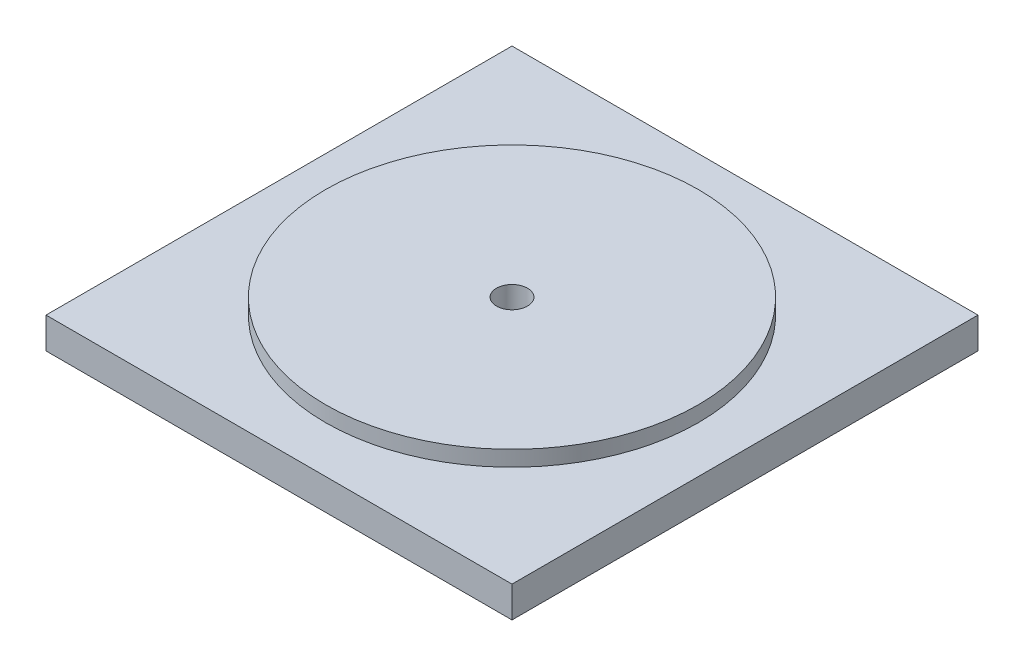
SolidWorks part; units mm, degrees
ref_plane "Front Plane" through (0, 0, 0) normal (0, 0, 1) x (1, 0, 0)
ref_plane "Top Plane" through (0, 0, 0) normal (0, 1, 0) x (1, 0, 0)
ref_plane "Right Plane" through (0, 0, 0) normal (1, 0, 0) x (0, 0, -1)
sketch "Sketch1" plane through (0, 0, 0) normal (0, 1, 0) x (1, 0, 0)
  line L1 (-75, 75) -> (75, 75)
  line L2 (-75, 75) -> (-75, -75)
  line L3 (-75, -75) -> (75, -75)
  line L4 (75, 75) -> (75, -75)
  line L5 (-75, 75) -> (75, -75) construction
  line L6 (-75, -75) -> (75, 75) construction
  point P0 (0, 0)
  dimension "D1" = 150
  dimension "D2" = 150
extrude "Boss-Extrude1" add sketch "Sketch1" against normal blind 10
sketch "Sketch2" plane through (0, 0, 0) normal (0, 1, 0) x (1, 0, 0)
  circle A0 centre (0, 0) radius 60
extrude "Boss-Extrude2" add sketch "Sketch2" along normal blind 5
sketch "Sketch3" plane through (0, 5, 0) normal (0, 1, 0) x (1, 0, 0)
  circle A0 centre (0, 0) radius 5
extrude "Cut-Extrude1" cut sketch "Sketch3" against normal through all
